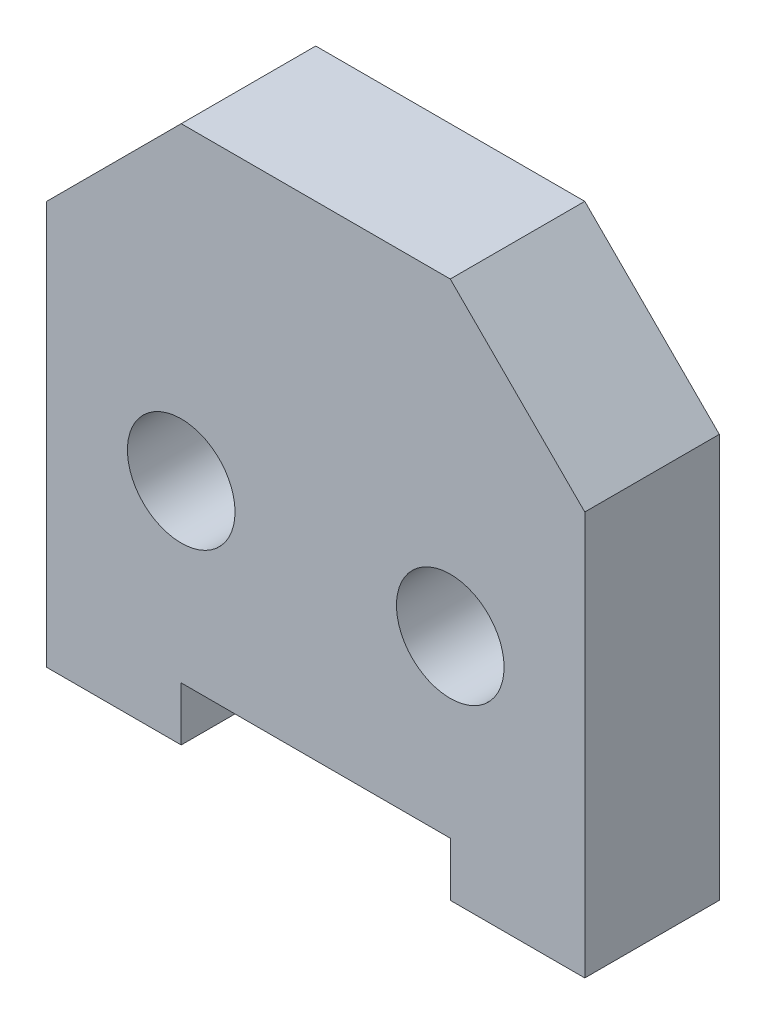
SolidWorks part; units mm, degrees
ref_plane "Plan de face" through (0, 0, 0) normal (0, 0, 1) x (1, 0, 0)
ref_plane "Plan de dessus" through (0, 0, 0) normal (0, 1, 0) x (1, 0, 0)
ref_plane "Plan de droite" through (0, 0, 0) normal (1, 0, 0) x (0, 0, -1)
sketch "Esquisse1" plane through (0, 0, 0) normal (0, 0, 1) x (1, 0, 0)
  line L0 (0, 0) -> (-40, 0)
  line L1 (-40, 0) -> (-40, 40)
  line L2 (-40, 40) -> (0, 40)
  line L3 (0, 40) -> (0, 0)
  dimension "D1" = 40
  dimension "D2" = 40
extrude "Boss.-Extru.1" add sketch "Esquisse1" along normal blind 10
chamfer "Chanfrein1" distance 10 angle 45 2 edges at (-40, 40, 5) (0, 40, 5)
sketch "Esquisse2" plane through (0, 0, 10) normal (0, 0, 1) x (1, 0, 0)
  line L0 (-40, 0) -> (0, 0) construction
  line L1 (0, 0) -> (0, 30) construction
  line L2 (-40, 30) -> (-40, 0) construction
  line L3 (-30, 0) -> (-10, 0)
  line L4 (-30, 0) -> (-30, 4)
  line L5 (-30, 4) -> (-10, 4)
  line L6 (-10, 0) -> (-10, 4)
  circle A0 centre (-30, 17) radius 4
  circle A1 centre (-10, 17) radius 4
  point P6 (0, 15)
  dimension "D1" = 8
  dimension "D2" = 8
  dimension "D5" = 20
  dimension "D6" = 10
  dimension "D3" = 17
  dimension "D4" = 17
  dimension "D7" = 20
  dimension "D8" = 4
  dimension "D9" = 10
extrude "Enlèv. mat.-Extru.1" cut sketch "Esquisse2" against normal blind 10
